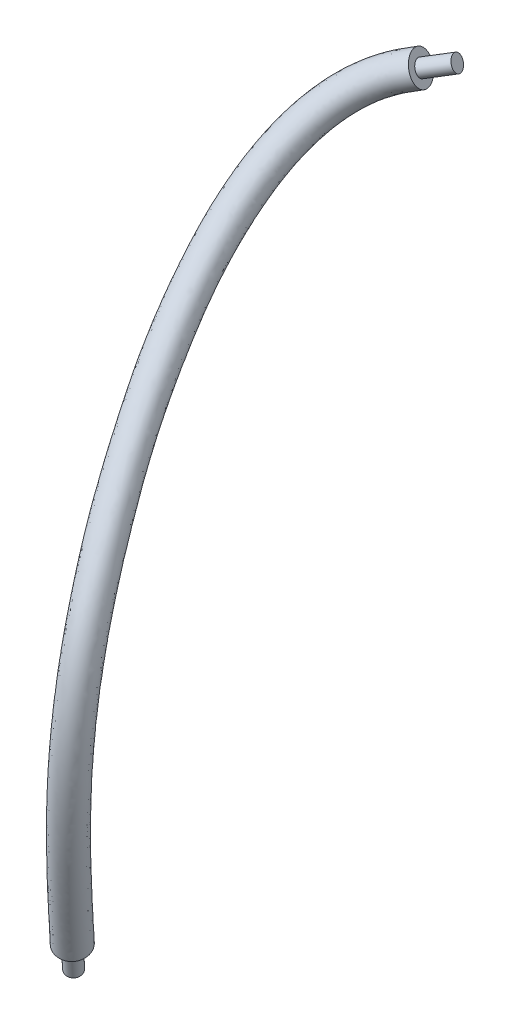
SolidWorks part; units mm, degrees
ref_plane "Plan de face" through (0, 0, 0) normal (0, 0, 1) x (1, 0, 0)
ref_plane "Plan de dessus" through (0, 0, 0) normal (0, 1, 0) x (1, 0, 0)
ref_plane "Plan de droite" through (0, 0, 0) normal (1, 0, 0) x (0, 0, -1)
sketch3d "Esquisse3D1"
  spline S0 degree 3 poles (-2.5941, 20.4198, -4.6004) (-1.8156, 23.8283, -3.6673) (0.077, 32.1143, -1.3991) (-5.5257, 38.4826, -12.7138) (-1.2514, 40.5512, -14.2165) (-1.0932, 40.6278, -14.2721) knots 0 0 0 0 0.402247 0.977868 1 1 1 1
ref_plane "Plan1" through (-1.0932, 40.6278, -14.2721) normal (0.8582, 0.4153, -0.3017) x (-0.2716, -0.1314, -0.9534)
sketch "Esquisse1" plane through (-1.0932, 40.6278, -14.2721) normal (0.8582, 0.4153, -0.3017) x (-0.2716, -0.1314, -0.9534)
  circle A0 centre (0, 0) radius 0.5
  dimension "D1" = 1
sweep "Balayage1" add profiles "Esquisse1" path "Esquisse3D1"
sketch "Esquisse2" plane through (17.3713, 8.4073, -6.107) normal (0.8582, 0.4153, -0.3017) x (-0.2716, -0.1314, -0.9534)
  circle A2 centre (8.5642, 37.0462) radius 0.25
  circle A3 centre (8.5642, 37.0462) radius 0.25
  dimension "D1" = 0.25
extrude "Extrusion1" add sketch "Esquisse2" along normal blind 1
sketch "Esquisse3" plane through (3.7627, 16.4741, 4.5096) normal (-0.2151, -0.9419, -0.2578) x (0.9766, -0.2075, -0.0568)
  circle A2 centre (-6.5093, -9.8285) radius 0.25
  circle A3 centre (-6.5093, -9.8285) radius 0.25
  dimension "D1" = 0.25
extrude "Extrusion2" add sketch "Esquisse3" along normal blind 1
